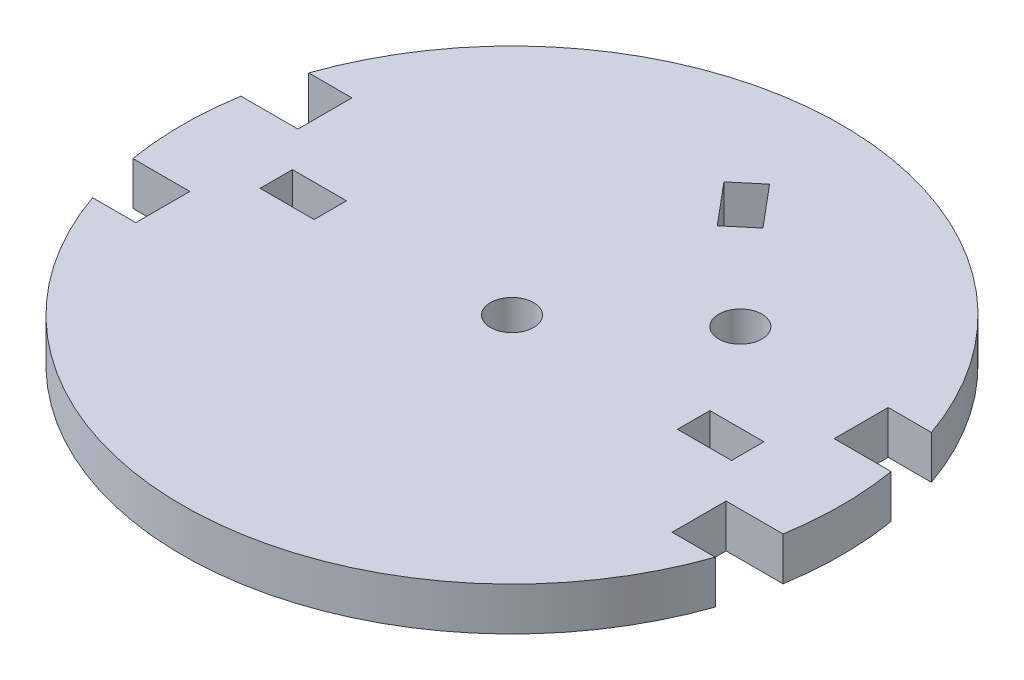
SolidWorks part; units mm, degrees
ref_plane "Alzado" through (0, 0, 0) normal (0, 0, 1) x (1, 0, 0)
ref_plane "Planta" through (0, 0, 0) normal (0, 1, 0) x (1, 0, 0)
ref_plane "Vista lateral" through (0, 0, 0) normal (1, 0, 0) x (0, 0, -1)
sketch "Croquis1" plane through (0, 0, 0) normal (0, 1, 0) x (1, 0, 0)
  circle A0 centre (0, 0) radius 30.5
extrude "Saliente-Extruir1" add sketch "Croquis1" along normal blind 4
sketch "Croquis2" plane through (0, 4, 0) normal (0, 1, 0) x (1, 0, 0)
  circle A0 centre (0, 0) radius 2
extrude "Cortar-Extruir1" cut sketch "Croquis2" against normal blind 4
sketch "Croquis5" plane through (0, 4, 0) normal (0, 1, 0) x (1, 0, 0)
  line L0 (0, 0) -> (0, 10)
  line L1 (28.8141, -5) -> (30.0874, -5)
  line L2 (28.8141, 5) -> (30.0874, 5)
  line L3 (-24.8141, 10) -> (-28.8141, 10)
  line L4 (24.8141, -5) -> (24.8141, -10)
  line L5 (-24.8141, -10) -> (-28.8141, -10)
  line L6 (24.8141, -5) -> (28.8141, -5)
  line L7 (24.8141, 5) -> (24.8141, 10)
  line L8 (-24.8141, 5) -> (-28.8141, 5)
  line L9 (-24.8141, 5) -> (-24.8141, 10)
  line L10 (-24.8141, -5) -> (-28.8141, -5)
  line L11 (-24.8141, -5) -> (-24.8141, -10)
  line L12 (24.8141, 5) -> (28.8141, 5)
  line L13 (24.8141, -10) -> (28.8141, -10)
  line L14 (24.8141, 10) -> (28.8141, 10)
  line L15 (-28.8141, 5) -> (-30.0874, 5)
  line L16 (-28.8141, -5) -> (-30.0874, -5)
  circle A1 centre (0, 0) radius 30.5 construction
  arc A2 (-28.8141, 10) -> (-30.0874, 5) centre (0, 0) ccw
  arc A3 (28.8141, 10) -> (28.8141, -10) centre (0, 0) cw
  arc A4 (-30.0874, -5) -> (-28.8141, -10) centre (0, 0) ccw
  arc A5 (30.0874, -5) -> (28.8141, -10) centre (0, 0) cw
  arc A6 (28.8141, 10) -> (30.0874, 5) centre (0, 0) cw
extrude "Cortar-Extruir3" cut sketch "Croquis5" against normal blind 4
sketch "Croquis6" plane through (0, 4, 0) normal (0, 1, 0) x (1, 0, 0)
  line L1 (-16.8141, -1.5) -> (-16.8141, 1.5)
  line L2 (-16.8141, 1.5) -> (-21.8141, 1.5)
  line L3 (-21.8141, 1.5) -> (-21.8141, -1.5)
  line L4 (-16.8141, -1.5) -> (-21.8141, -1.5)
  line L5 (16.8141, -1.5) -> (21.8141, -1.5)
  line L6 (21.8141, 1.5) -> (21.8141, -1.5)
  line L7 (16.8141, 1.5) -> (21.8141, 1.5)
  line L8 (16.8141, -1.5) -> (16.8141, 1.5)
extrude "Cortar-Extruir4" cut sketch "Croquis6" against normal blind 4
sketch "Croquis7" plane through (0, 4, 0) normal (0, 1, 0) x (1, 0, 0)
  line L0 (-8.1011, 29.1011) -> (9.5756, 8.0348)
  line L1 (9.5756, 8.0348) -> (27.2522, -13.0314)
  line L2 (-8.1011, 29.1011) -> (-27.2522, 13.0314)
  line L3 (27.2522, -13.0314) -> (8.1011, -29.1011)
  line L4 (8.1011, -29.1011) -> (-27.2522, 13.0314)
  line L5 (1.4284, 22.4114) -> (-0.8697, 20.4831)
  line L6 (1.4284, 22.4114) -> (4.6423, 18.5812)
  line L7 (4.6423, 18.5812) -> (2.3442, 16.6528)
  line L8 (2.3442, 16.6528) -> (-0.8697, 20.4831)
  circle A0 centre (11.4907, 9.6418) radius 2
  point P7 (-9.5756, -8.0348)
extrude "Cortar-Extruir5" cut sketch "Croquis7" against normal blind 4 contours A0 | L7 L6 L5 L0
